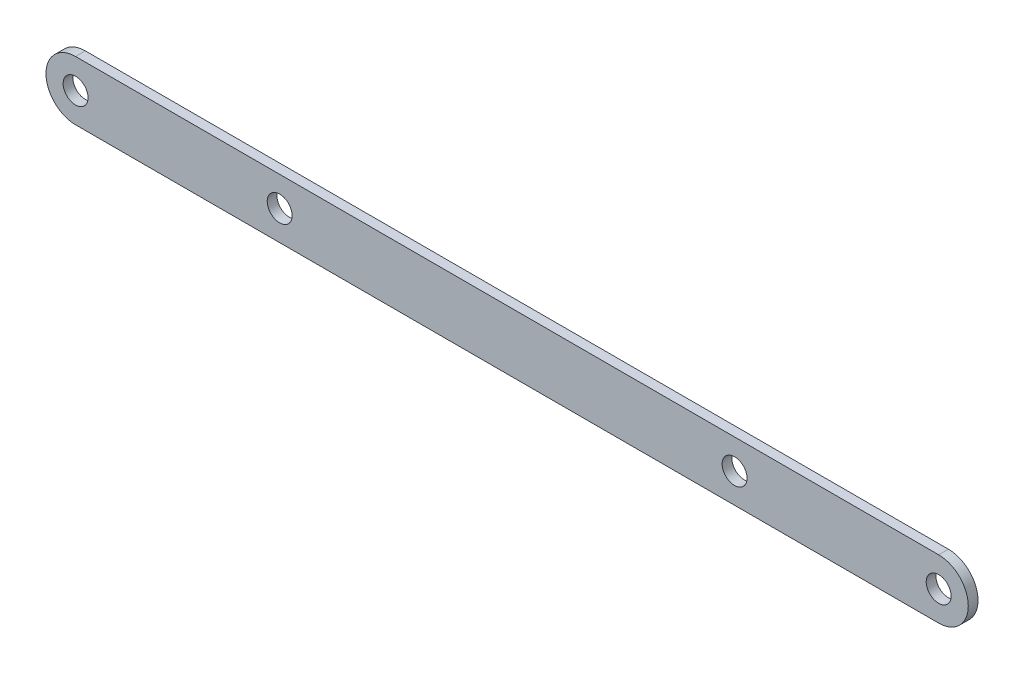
SolidWorks part; units mm, degrees
ref_plane "Front Plane" through (0, 0, 0) normal (0, 0, 1) x (1, 0, 0)
ref_plane "Top Plane" through (0, 0, 0) normal (0, 1, 0) x (1, 0, 0)
ref_plane "Right Plane" through (0, 0, 0) normal (1, 0, 0) x (0, 0, -1)
sketch "Sketch1" plane through (0, 0, 0) normal (0, 0, 1) x (1, 0, 0)
  line L0 (-148.38, -12.7) -> (-7.62, -12.7) construction
  line L1 (-148.38, -7.874) -> (-7.62, -7.874)
  line L2 (-148.38, -17.526) -> (-7.62, -17.526)
  circle A0 centre (-148.38, -12.7) radius 2.032
  circle A1 centre (-115.095, -12.7) radius 2.032
  circle A2 centre (-40.905, -12.7) radius 2.032
  circle A3 centre (-7.62, -12.7) radius 2.032
  circle A4 centre (-40.905, -12.7) radius 2.032 construction
  arc A5 (-148.38, -7.874) -> (-148.38, -17.526) centre (-148.38, -12.7) ccw
  arc A6 (-7.62, -17.526) -> (-7.62, -7.874) centre (-7.62, -12.7) ccw
  point P14 (-78, -12.7)
  dimension "D1" = 9.652
extrude "Boss-Extrude1" add sketch "Sketch1" along normal blind 1.5875
